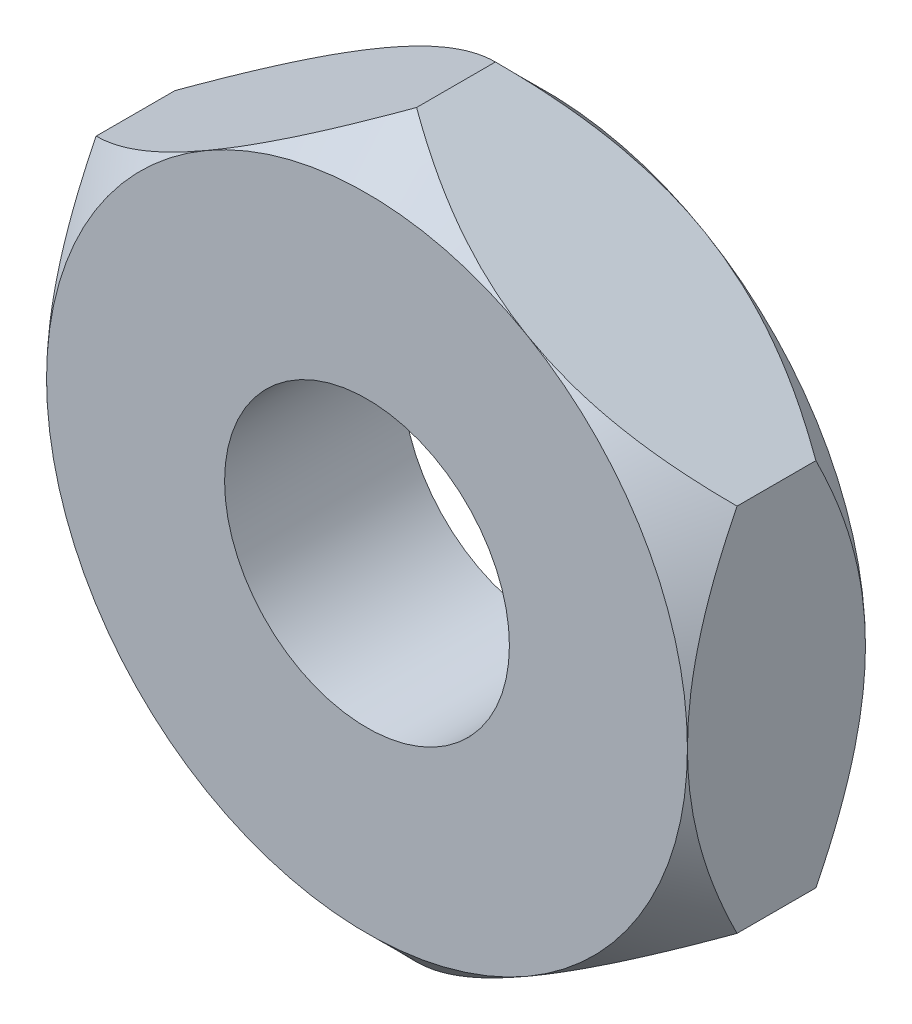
SolidWorks part; units mm, degrees
ref_plane "Plan1" through (0, 0, 0) normal (0, 0, 1) x (1, 0, 0)
ref_plane "Plan2" through (0, 0, 0) normal (0, 1, 0) x (1, 0, 0)
ref_plane "Plan3" through (0, 0, 0) normal (1, 0, 0) x (0, 0, -1)
sketch "E_corps" plane through (0, 0, 0) normal (0, 0, 1) x (1, 0, 0)
  line L0 (0, 91.6337) -> (0, -97.1696) construction
  line L1 (0, 10.3923) -> (9, 5.1962)
  line L2 (0, 10.3923) -> (-9, 5.1962)
  line L3 (9, 5.1962) -> (9, -5.1962)
  line L4 (-9, 5.1962) -> (-9, -5.1962)
  line L5 (9, -5.1962) -> (0, -10.3923)
  line L6 (-9, -5.1962) -> (0, -10.3923)
  circle A0 centre (0, 0) radius 10.3923 construction
  dimension "a" = 18
extrude "Corps" add sketch "E_corps" along normal blind 5
sketch "E_chanfrein" plane through (0, 0, 5) normal (0, 0, 1) x (1, 0, 0)
  line L0 (9, 5.1962) -> (9, -5.1962) construction
  circle A0 centre (0, 0) radius 9
extrude "Chanfrein" cut sketch "E_chanfrein" against normal through all draft 45 flip side to cut
ref_plane "Plan_de_symétrie" through (0, 0, 2.5) normal (0, 0, 1) x (1, 0, 0)
mirror "Symétrie" about plane through (0, 0, 2.5) normal (0, 0, 1)
sketch "E_perçage" plane through (0, 0, 0) normal (0, 0, -1) x (-1, 0, 0)
  circle A0 centre (0, 0) radius 4
  dimension "Diamètre_nominale" = 8
extrude "Perçage_diamètre_nominal" cut sketch "E_perçage" against normal through all
equation "\"D1@Plan_de_symétrie\" = 0.5*\"Hauteur@Corps\""
